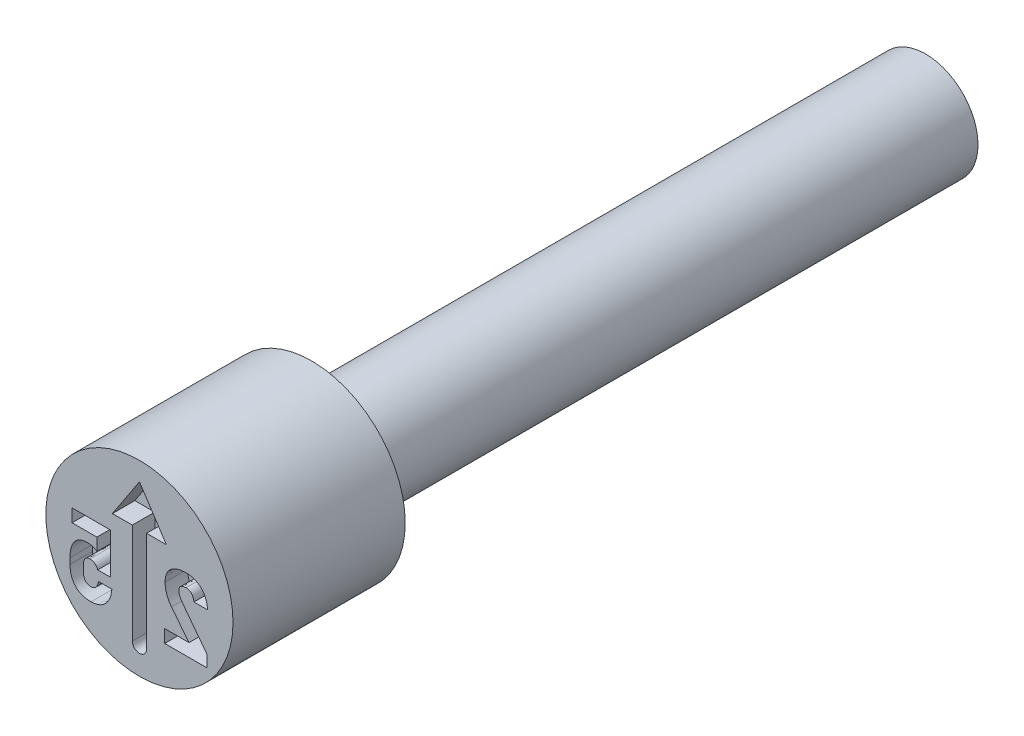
SolidWorks part; units mm, degrees
ref_plane "Front Plane" through (0, 0, 0) normal (0, 0, 1) x (1, 0, 0)
ref_plane "Top Plane" through (0, 0, 0) normal (0, 1, 0) x (1, 0, 0)
ref_plane "Right Plane" through (0, 0, 0) normal (1, 0, 0) x (0, 0, -1)
sketch "Sketch2" plane through (0, 0, 0) normal (1, 0, 0) x (0, 0, -1)
  line L0 (0.4039, 0) -> (50000.4039, 0) construction
  line L6 (0, 1.25) -> (0, 0)
  line L7 (2.3, 1.25) -> (0, 1.25)
  line L8 (2.3, 0.7) -> (2.3, 1.25)
  line L9 (10.5, 0.7) -> (2.3, 0.7)
  line L10 (10.5, 0) -> (10.5, 0.7)
  line L11 (0, 0) -> (10.5, 0)
  dimension "D1" = 2.5
  dimension "D2" = 1.4
  dimension "D3" = 10.5
  dimension "D4" = 2.3
revolve "Revolve1" add sketch "Sketch2" angle 360 about L0
sketch "Sketch3" plane through (0, 0, 0) normal (0, 0, 1) x (1, 0, 0)
  line L0 (0, 0) -> (0, 50000) construction
  line L1 (0.0952, 0.4532) -> (0.0952, -0.8881)
  line L2 (0.361, 0.4532) -> (0.0952, 0.4532)
  line L3 (0, 1.0011) -> (0.361, 0.4532)
  line L15 (0, 1.0011) -> (-0.361, 0.4532)
  line L16 (-0.361, 0.4532) -> (-0.0952, 0.4532)
  line L17 (-0.0952, 0.4532) -> (-0.0952, -0.8881)
  arc A2 (-0.0952, -0.8881) -> (0.0952, -0.8881) centre (0, -0.8881) ccw
extrude "Cut-Extrude4" cut sketch "Sketch3" against normal blind 0.3
sketch "Sketch4" plane through (0, 0, 0) normal (0, 0, 1) x (1, 0, 0)
  text T0 "2  5" font "Bahnschrift" height 0.95
  dimension "D1" = 0.7
extrude "Cut-Extrude5" cut sketch "Sketch4" against normal blind 0.3
